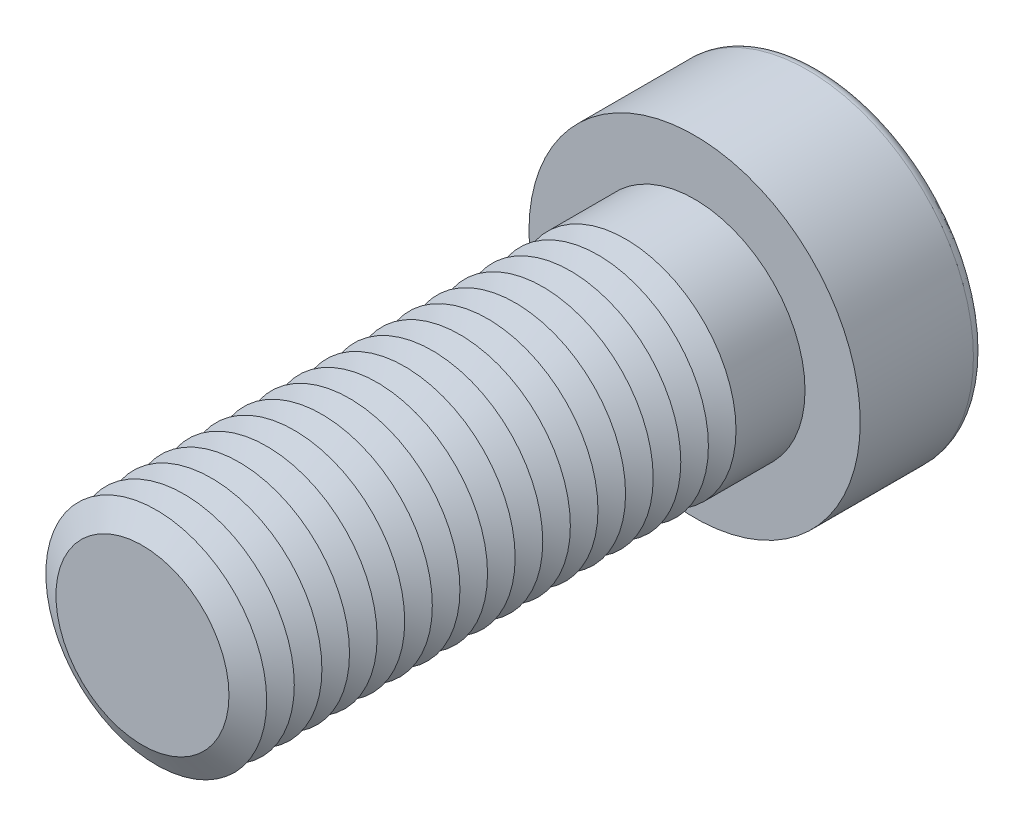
SolidWorks part; units mm, degrees
ref_plane "Front Plane" through (0, 0, 0) normal (0, 0, 1) x (1, 0, 0)
ref_plane "Top Plane" through (0, 0, 0) normal (0, 1, 0) x (1, 0, 0)
ref_plane "Right Plane" through (0, 0, 0) normal (1, 0, 0) x (0, 0, -1)
sketch "Sketch1" plane through (0, 0, 0) normal (0, 0, 1) x (1, 0, 0)
  circle A0 centre (0, 0) radius 8
  dimension "D1" = 16
extrude "Boss-Extrude1" add sketch "Sketch1" along normal blind 40
sketch "Sketch2" plane through (0, 0, 0) normal (0, 0, -1) x (-1, 0, 0)
  circle A0 centre (0, 0) radius 12
  dimension "D1" = 24
extrude "Boss-Extrude2" add sketch "Sketch2" along normal blind 9
sketch "Sketch3" plane through (0, 0, -9) normal (0, 0, -1) x (-1, 0, 0)
  line L1 (-3.4641, 6) -> (-6.9282, 0)
  line L2 (-6.9282, 0) -> (-3.4641, -6)
  line L3 (-3.4641, -6) -> (3.4641, -6)
  line L4 (3.4641, -6) -> (6.9282, 0)
  line L5 (6.9282, 0) -> (3.4641, 6)
  line L6 (3.4641, 6) -> (-3.4641, 6)
  circle A0 centre (0, 0) radius 6 construction
  dimension "D1" = 12
extrude "Cut-Extrude1" cut sketch "Sketch3" against normal blind 9
fillet "Fillet1" radius 0.8 1 edges at (-12, 0, -9)
sketch "Sketch4" plane through (0, 0, 0) normal (0, 0, -1) x (-1, 0, 0)
  line L0 (3.4641, -6) -> (6.9282, 0) construction
  circle A0 centre (0, 0) radius 6
extrude "Cut-Extrude2" cut sketch "Sketch4" against normal through all draft 60
sketch "Sketch5" plane through (0, 0, -9) normal (0, 0, -1) x (-1, 0, 0)
  circle A0 centre (0, 0) radius 6.9282
extrude "Cut-Extrude3" cut sketch "Sketch5" against normal through all draft 75
sketch "Sketch7" plane through (0, 0, 0) normal (1, 0, 0) x (0, 0, -1)
  line L25 (-40, 6.2679) -> (-39, 8)
  line L26 (-40, 8) -> (-40, -8) construction
  line L27 (-39, 8) -> (-41, 8)
  line L28 (-41, 8) -> (-40, 6.2679)
  line L29 (0, 8) -> (-40, 8) construction
  dimension "D1" = 2
revolve "Cut-Revolve1" cut sketch "Sketch7" angle 360 about axis through (0, 0, 40) along (0, 0, -1)
pattern_linear "LPattern1" count 18 spacing 2 along (0, 0, -1) of "Cut-Revolve1"
